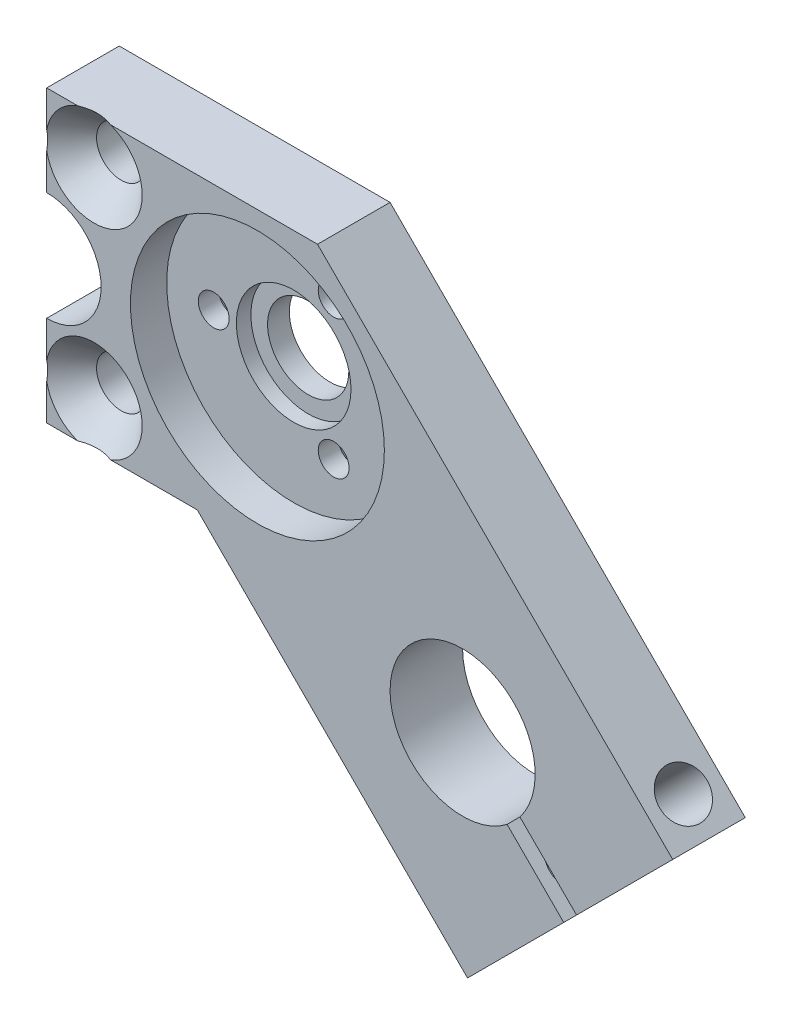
SolidWorks part; units mm, degrees
ref_plane "Front Plane" through (0, 0, 0) normal (0, 0, 1) x (1, 0, 0)
ref_plane "Top Plane" through (0, 0, 0) normal (0, 1, 0) x (1, 0, 0)
ref_plane "Right Plane" through (0, 0, 0) normal (1, 0, 0) x (0, 0, -1)
sketch "Sketch1" plane through (0, 0, 0) normal (0, 0, 1) x (1, 0, 0)
  line L0 (-18.4404, -4.7625) -> (-18.4404, -12.7)
  line L1 (-5.2605, -12.7) -> (18.3916, -36.3521)
  line L2 (18.3916, -36.3521) -> (26.8106, -27.9331)
  line L3 (36.3521, -18.3916) -> (5.2605, 12.7)
  line L4 (0, 0) -> (-24.2979, 0) construction
  line L5 (-13.0393, 13.0393) -> (27.8682, -27.8682) construction
  line L6 (22.9767, -21.8542) -> (27.9331, -26.8106)
  line L7 (26.8106, -27.9331) -> (21.8542, -22.9767)
  line L8 (27.9331, -26.8106) -> (36.3521, -18.3916)
  line L9 (-18.4404, 12.7) -> (-18.4404, 4.7625)
  line L10 (-18.4404, 12.7) -> (5.2605, 12.7)
  line L11 (-18.4404, -12.7) -> (-5.2605, -12.7)
  line L12 (-18.4404, 4.7625) -> (-18.4404, -4.7625) construction
  circle A0 centre (0, 0) radius 3.556
  arc A1 (22.9767, -21.8542) -> (21.8542, -22.9767) centre (17.9605, -17.9605) ccw
  arc A2 (-18.4404, -4.7625) -> (-18.4404, 4.7625) centre (-18.4404, 0) ccw
  dimension "D5" = 7.112
  dimension "D6" = 12.7
  dimension "D7" = 25.4
  dimension "D12" = 12.7
  dimension "D13" = 18.4404
  dimension "D14" = 9.525
  dimension "D16" = 18.4404
  dimension "D2" = 135
  dimension "D3" = 43.9701
  dimension "D4" = 12.7
  dimension "D8" = 0.7937
  dimension "D9" = 1.5875
  dimension "D10" = 25.4
  dimension "D11" = 25.4
  dimension "D15" = 12.7
extrude "Extrude1" add sketch "Sketch1" along normal blind 6.35
hole_wizard "CSK for #8 Flat Head Machine Screw1" positions "3DSketch1" profile "Sketch2" countersink size "#8" standard "Ansi Inch"
sketch3d "3DSketch1"
  line L0 (5.2605, 12.7, 6.35) -> (-18.4404, 12.7, 6.35) construction
  line L1 (-18.4404, -12.7, 6.35) -> (-5.2605, -12.7, 6.35) construction
  line L2 (-18.4404, 12.7, 6.35) -> (-18.4404, 4.7625, 6.35) construction
  point P0 (-14.3002, 8.7376, 6.35)
  point P2 (-14.3002, -8.7376, 6.35)
  dimension "D1" = 3.9624
  dimension "D2" = 3.9624
  dimension "D3" = 4.1402
  dimension "D4" = 4.1402
sketch "Sketch2" plane through (-14.3002, 8.7376, 6.35) normal (1, 0, 0) x (0, -1, 0)
  line L0 (0, 0) -> (0, 6.35)
  line L1 (0, 6.35) -> (2.1526, 6.35)
  line L2 (2.1526, 6.35) -> (2.1526, 2.3741)
  line L3 (2.1526, 2.3741) -> (4.2164, 0)
  line L5 (4.2164, 0) -> (0, 0)
  line L6 (-2.1526, 2.3741) -> (-4.2164, 0) construction
  line L11 (0, -6.35) -> (0, 107.95) construction
  dimension "Thru Hole Dia." = 4.3053
  dimension "Thru Hole Depth" = 6.35
  dimension "Near C'Sink Dia." = 8.4328
  dimension "Near C'Sink Angle" = 82
sketch "Sketch3" plane through (0, 0, 6.35) normal (0, 0, 1) x (1, 0, 0)
  circle A0 centre (0, 0) radius 11.1125
  dimension "D1" = 22.225
extrude "Cut-Extrude1" cut sketch "Sketch3" against normal blind 3.175
sketch "Sketch4" plane through (0, 0, 3.175) normal (0, 0, 1) x (1, 0, 0)
  circle A0 centre (0, 0) radius 5.0165
  dimension "D1" = 10.033
extrude "Cut-Extrude2" cut sketch "Sketch4" against normal blind 1.27
sketch "Sketch5" plane through (0, 0, 3.175) normal (0, 0, 1) x (1, 0, 0)
  circle A0 centre (0, 0) radius 7.0104 construction
  point P3 (-7.0104, 0)
  dimension "D1" = 14.0208
hole_wizard "CSK for M2.5 Flat Head Machine Screw1" positions "3DSketch2" profile "Sketch6" countersink size "M2.5" standard "Ansi Metric"
sketch3d "3DSketch2"
  point P0 (-7.0004, 0, 0)
sketch "Sketch6" plane through (-7.0004, 0, 0) normal (1, 0, 0) x (0, 1, 0)
  line L0 (0, 0) -> (0, 6.35)
  line L1 (0, 6.35) -> (1.35, 6.35)
  line L2 (1.35, 6.35) -> (1.35, 1.4)
  line L3 (1.35, 1.4) -> (2.75, 0)
  line L5 (2.75, 0) -> (0, 0)
  line L6 (-1.35, 1.4) -> (-2.75, 0) construction
  line L11 (0, -6.35) -> (0, 107.95) construction
  dimension "Thru Hole Dia." = 2.7
  dimension "Thru Hole Depth" = 6.35
  dimension "Near C'Sink Dia." = 5.5
  dimension "Near C'Sink Angle" = 90
pattern_circular "CirPattern1" count 3 over 360 about axis through (0, 0, 0) along (0, 0, 1) of "CSK for M2.5 Flat Head Machine Screw1"
hole_wizard "#8 Clearance Hole1" positions "3DSketch3" profile "Sketch7" hole size "#8" standard "Ansi Inch"
sketch3d "3DSketch3"
  line L0 (-5.2605, -12.7, 0) -> (18.3916, -36.3521, 0) construction
  line L1 (18.3916, -36.3521, 6.35) -> (18.3916, -36.3521, 0) construction
  point P0 (16.1465, -34.107, 3.175)
  dimension "D1" = 3.175
  dimension "D2" = 3.175
sketch "Sketch7" plane through (16.1465, -34.107, 3.175) normal (0, 0, 1) x (0.7071, -0.7071, 0)
  line L0 (0, 0) -> (0, 13.9934)
  line L1 (0, 13.9934) -> (2.1526, 12.7)
  line L2 (2.1526, 12.7) -> (2.1526, 0)
  line L5 (2.1526, 0) -> (0, 0)
  line L10 (0, 13.9934) -> (-2.1527, 12.7) construction
  line L11 (0, -6.35) -> (0, 107.95) construction
  dimension "Hole Dia." = 4.3053
  dimension "Hole Depth" = 12.7
  dimension "Drill Angle" = 118
hole_wizard "#8-32 Tapped Hole1" positions "3DSketch4" profile "Sketch8" tap size "#8-32" standard "Ansi Inch"
sketch3d "3DSketch4"
  line L0 (36.3521, -18.3916, 6.35) -> (36.3521, -18.3916, 0) construction
  line L1 (36.3521, -18.3916, 6.35) -> (5.2605, 12.7, 6.35) construction
  point P0 (34.107, -16.1465, 3.175)
  dimension "D1" = 3.175
  dimension "D2" = 3.175
sketch "Sketch8" plane through (34.107, -16.1465, 3.175) normal (0, 0, 1) x (-0.7071, 0.7071, 0)
  line L0 (0, 0) -> (0, 16.0238)
  line L1 (0, 16.0238) -> (1.7272, 14.986)
  line L2 (1.7272, 14.986) -> (1.7272, 12.7)
  line L3 (1.7272, 12.7) -> (2.0828, 12.7)
  line L4 (2.0828, 12.7) -> (2.0828, 0)
  line L5 (2.0828, 0) -> (0, 0)
  line L10 (0, 16.0238) -> (-1.7272, 14.986) construction
  line L11 (0, -6.35) -> (0, 107.95) construction
  dimension "Tap Drill Dia." = 3.4544
  dimension "Tap Drill Depth" = 14.986
  dimension "Thread Major Dia." = 4.1656
  dimension "Thread Depth" = 12.7
  dimension "Drill Angle" = 118
